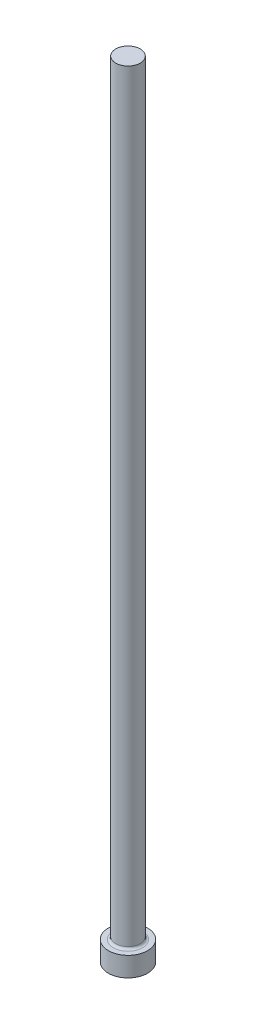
SolidWorks part; units mm, degrees
ref_plane "Front Plane" through (0, 0, 0) normal (0, 0, 1) x (1, 0, 0)
ref_plane "Top Plane" through (0, 0, 0) normal (0, 1, 0) x (1, 0, 0)
ref_plane "Right Plane" through (0, 0, 0) normal (1, 0, 0) x (0, 0, -1)
sketch "Sketch1" plane through (0, 0, 0) normal (0, 0, 1) x (1, 0, 0)
  line L0 (0, 0) -> (6.35, 0)
  line L1 (55, 0) -> (-55, 0) construction
  line L2 (6.35, 0) -> (6.35, 6.35)
  line L3 (6.35, 6.35) -> (4.7307, 6.35)
  line L4 (3.9688, 7.112) -> (3.9688, 254)
  line L5 (3.9688, 254) -> (0, 254)
  line L6 (0, 254) -> (0, 0)
  arc A0 (4.7307, 6.35) -> (3.9688, 7.112) centre (4.7307, 7.112) cw
  dimension "D5" = 0.762
  dimension "D1" = 3.9688
  dimension "D2" = 6.35
  dimension "D3" = 6.35
  dimension "D4" = 254
revolve "Revolve1" add sketch "Sketch1" angle 360 about L6
